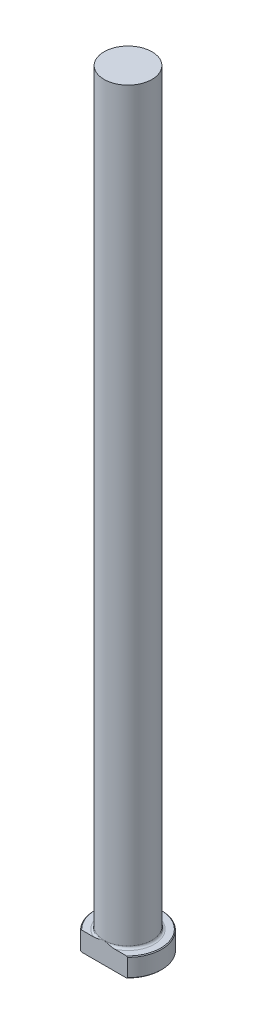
SolidWorks part; units mm, degrees
ref_plane "Front Plane" through (0, 0, 0) normal (0, 0, 1) x (1, 0, 0)
ref_plane "Top Plane" through (0, 0, 0) normal (0, 1, 0) x (1, 0, 0)
ref_plane "Right Plane" through (0, 0, 0) normal (1, 0, 0) x (0, 0, -1)
sketch "Sketch1" plane through (0, 0, 0) normal (0, 0, 1) x (1, 0, 0)
  line L0 (0, 259.9588) -> (0, -15.1925) construction
  line L1 (0, 0) -> (-11.1125, 0)
  line L2 (-11.1125, 0) -> (-11.1125, 6.35)
  line L3 (-11.1125, 6.35) -> (-7.9375, 6.35)
  line L4 (-7.9375, 6.35) -> (-7.9375, 254)
  line L5 (-7.9375, 254) -> (0, 254)
  line L6 (0, 254) -> (0, 0)
  dimension "L" = 254
  dimension "H" = 22.225
  dimension "T" = 6.35
  dimension "D" = 15.875
revolve "Revolve1" add sketch "Sketch1" angle 360 about L0
chamfer "Chamfer1" distance 0.254 angle 45 2 edges at (0, 6.35, 11.1125) (0, 0, 11.1125)
fillet "Fillet1" radius 0.762 1 edges at (0, 6.35, 7.9375)
sketch "Sketch2" plane through (0, 0, 0) normal (0, -1, 0) x (1, 0, 0)
  line L0 (-7.7771, 7.9375) -> (7.7771, 7.9375)
  arc A0 (7.7771, 7.9375) -> (-7.7771, 7.9375) centre (0, 0) ccw
  circle A1 centre (0, 0) radius 11.1125 construction
  circle A3 centre (0, 0) radius 7.9375 construction
extrude "KEY" cut sketch "Sketch2" against normal through all
sketch "Pocket Sketch" plane through (0, 0, 0) normal (0, 0, 1) x (1, 0, 0)
  line L0 (-11.5094, 0) -> (-11.5094, 6.3754)
  line L1 (-11.5094, 6.3754) -> (-9.0964, 6.3754)
  line L2 (-8.3344, 7.1374) -> (-8.3344, 22.225)
  line L3 (-8.3344, 22.225) -> (0, 22.225)
  line L4 (0, 22.225) -> (0, 0)
  line L5 (0, 0) -> (-11.5094, 0)
  line L6 (0, 12.6104) -> (0, -2.4989) construction
  line L7 (-11.1125, 6.096) -> (-11.1125, 0.254) construction
  line L8 (10.8585, 6.35) -> (-10.8585, 6.35) construction
  line L9 (-7.9375, 254) -> (-7.9375, 7.112) construction
  line L10 (-9.0964, 6.3754) -> (-8.3344, 7.1374)
  point P3 (-8.3344, 6.3754)
  dimension "D1" = 23.0187
  dimension "D2" = 0.3969
  dimension "D3" = 0.0254
  dimension "D4" = 0.3969
  dimension "D5" = 16.6687
  dimension "D6" = 22.225
